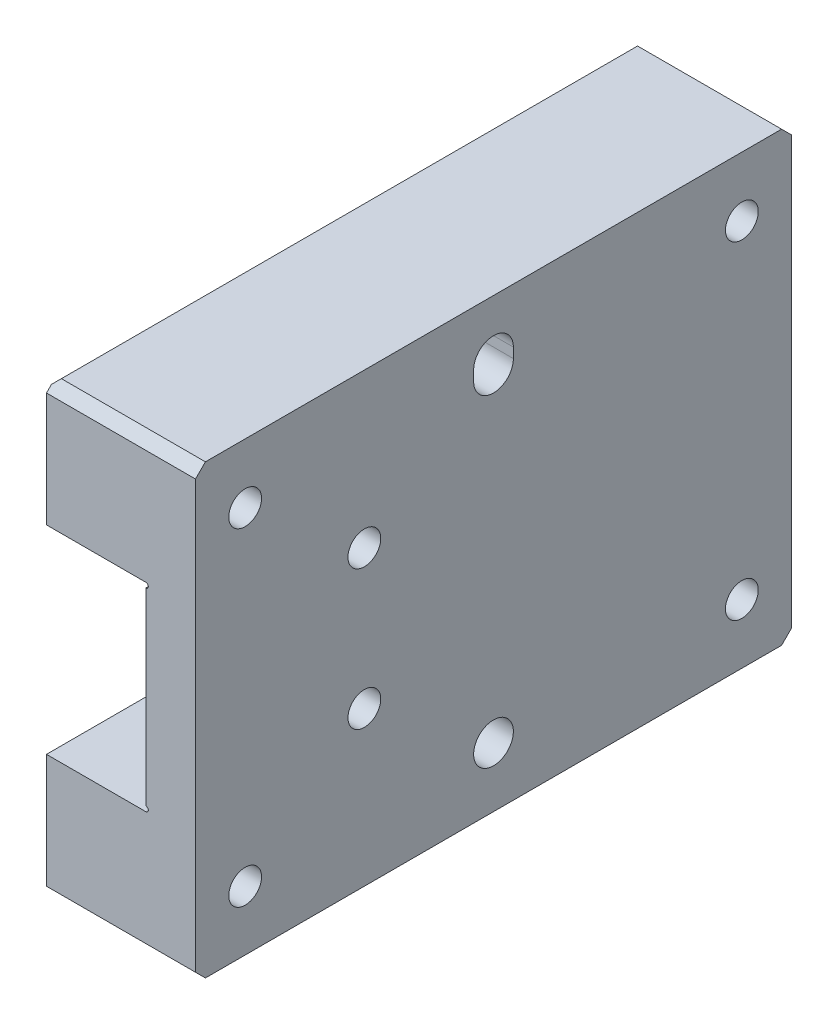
SolidWorks part; units mm, degrees
ref_plane "前视基准面" through (0, 0, 0) normal (0, 0, 1) x (1, 0, 0)
ref_plane "上视基准面" through (0, 0, 0) normal (0, 1, 0) x (1, 0, 0)
ref_plane "右视基准面" through (0, 0, 0) normal (1, 0, 0) x (0, 0, -1)
sketch "草图1" plane through (0, 0, 0) normal (0, 0, 1) x (1, 0, 0)
  line L1 (-7.5, -22.5) -> (7.5, -22.5)
  line L2 (-7.5, -22.5) -> (-7.5, 22.5)
  line L3 (-7.5, 22.5) -> (7.5, 22.5)
  line L4 (7.5, -22.5) -> (7.5, 22.5)
  line L5 (-7.5, -22.5) -> (7.5, 22.5) construction
  line L6 (-7.5, 22.5) -> (7.5, -22.5) construction
  point P0 (0, 0)
  dimension "D1" = 15
  dimension "D2" = 45
extrude "凸台-拉伸1" add sketch "草图1" along normal blind 60
sketch "草图2" plane through (-7.5, 0, 0) normal (-1, 0, 0) x (0, 0, 1)
  line L0 (60, 22.5) -> (60, -22.5) construction
  line L1 (60, 10) -> (0, 10)
  line L2 (60, 10) -> (60, -10)
  line L3 (60, -10) -> (0, -10)
  line L4 (0, 10) -> (0, -10)
  line L5 (0, 22.5) -> (0, -22.5) construction
  line L6 (60, 0) -> (45.252, 0) construction
  dimension "D1" = 20
extrude "切除-拉伸1" cut sketch "草图2" against normal blind 10
chamfer "倒角2" distance 0.5 angle 45 2 edges at (-7.5, -22.5, 30) (-7.5, 22.5, 30)
sketch "草图12" plane through (0, 0, 60) normal (0, 0, 1) x (1, 0, 0)
  line L0 (2.5, -10) -> (2.5, 10) construction
  circle A0 centre (2.5, 9.75) radius 0.25
  circle A1 centre (2.5, -9.75) radius 0.25
  dimension "D1" = 0.5
extrude "切除-拉伸2" cut sketch "草图12" against normal through all
hole_wizard "M4 螺纹孔1" positions "草图13" profile "草图14" tap size "M4" standard "ISO"
sketch "草图13" plane through (7.5, 0, 0) normal (1, 0, 0) x (0, 0, -1)
  line L0 (-60, 0) -> (0, 0) construction
  line L1 (-60, -22.5) -> (-60, 22.5) construction
  line L4 (-30, 22.5) -> (-30, -22.5) construction
  line L5 (-60, 22.5) -> (0, 22.5) construction
  line L6 (-60, -22.5) -> (0, -22.5) construction
  point P0 (-55, 16.5)
  point P2 (-5, 16.5)
  point P4 (-55, -16.5)
  point P6 (-5, -16.5)
  dimension "D1" = 50
  dimension "D2" = 33
sketch "草图14" plane through (7.5, 16.5, 55) normal (0, 1, 0) x (0, 0, -1)
  line L0 (0, 0) -> (0, 15)
  line L1 (0, 15) -> (1.65, 15)
  line L2 (1.65, 15) -> (1.65, 0)
  line L5 (1.65, 0) -> (0, 0)
  line L11 (0, -6.35) -> (0, 107.95) construction
  dimension "通孔螺纹孔钻头直径" = 3.3
  dimension "通孔螺纹孔钻头深度" = 15
hole_wizard "Ø4.0mm 暗销孔1" positions "草图15" profile "草图16" hole size "Ø4.0" standard "ISO"
sketch "草图15" plane through (7.5, 0, 0) normal (1, 0, 0) x (0, 0, -1)
  line L0 (-55, 16.5) -> (-5, 16.5) construction
  line L3 (-55, -16.5) -> (-5, -16.5) construction
  point P0 (-30, 16.5)
  point P2 (-30, -16.5)
sketch "草图16" plane through (7.5, 16.5, 30) normal (0, 1, 0) x (0, 0, -1)
  line L0 (0, 0) -> (0, 15)
  line L1 (0, 15) -> (2, 15)
  line L2 (2, 15) -> (2, 0)
  line L5 (2, 0) -> (0, 0)
  line L11 (0, -6.35) -> (0, 107.95) construction
  dimension "通孔孔直径" = 4
  dimension "通孔孔深度" = 15
sketch "草图17" plane through (7.5, 0, 0) normal (1, 0, 0) x (0, 0, -1)
  line L0 (-30, 17) -> (-30, 16) construction
  line L1 (-28, 17) -> (-28, 16)
  line L2 (-32, 17) -> (-32, 16)
  arc A0 (-28, 17) -> (-32, 17) centre (-30, 17) ccw
  arc A1 (-32, 16) -> (-28, 16) centre (-30, 16) ccw
  circle A2 centre (-30, 16.5) radius 2 construction
  point P2 (-30, 16.5)
  dimension "D1" = 1
extrude "切除-拉伸3" cut sketch "草图17" against normal through all
chamfer "倒角3" distance 1 angle 45 4 edges at (0.25, 22.5, 0) (0.25, -22.5, 0) (0.25, -22.5, 60) (0.25, 22.5, 60)
hole_wizard "M4 螺纹孔2" positions "草图18" profile "草图19" tap size "M4" standard "ISO"
sketch "草图18" plane through (7.5, 0, 0) normal (1, 0, 0) x (0, 0, -1)
  line L0 (0, 0) -> (-50000, 0) construction
  line L1 (-60, -21.5) -> (-60, 21.5) construction
  point P3 (-43, -7)
  point P13 (-43, 7)
  dimension "D1" = 14
  dimension "D2" = 17
sketch "草图19" plane through (7.5, -7, 43) normal (0, 1, 0) x (0, 0, -1)
  line L0 (0, 0) -> (0, 11.0914)
  line L1 (0, 11.0914) -> (1.65, 10.1)
  line L2 (1.65, 10.1) -> (1.65, 0)
  line L5 (1.65, 0) -> (0, 0)
  line L10 (0, 11.0914) -> (-1.65, 10.1) construction
  line L11 (0, -6.35) -> (0, 107.95) construction
  dimension "螺纹孔钻头直径" = 3.3
  dimension "螺纹孔钻头深度" = 10.1
  dimension "导头角度" = 118
